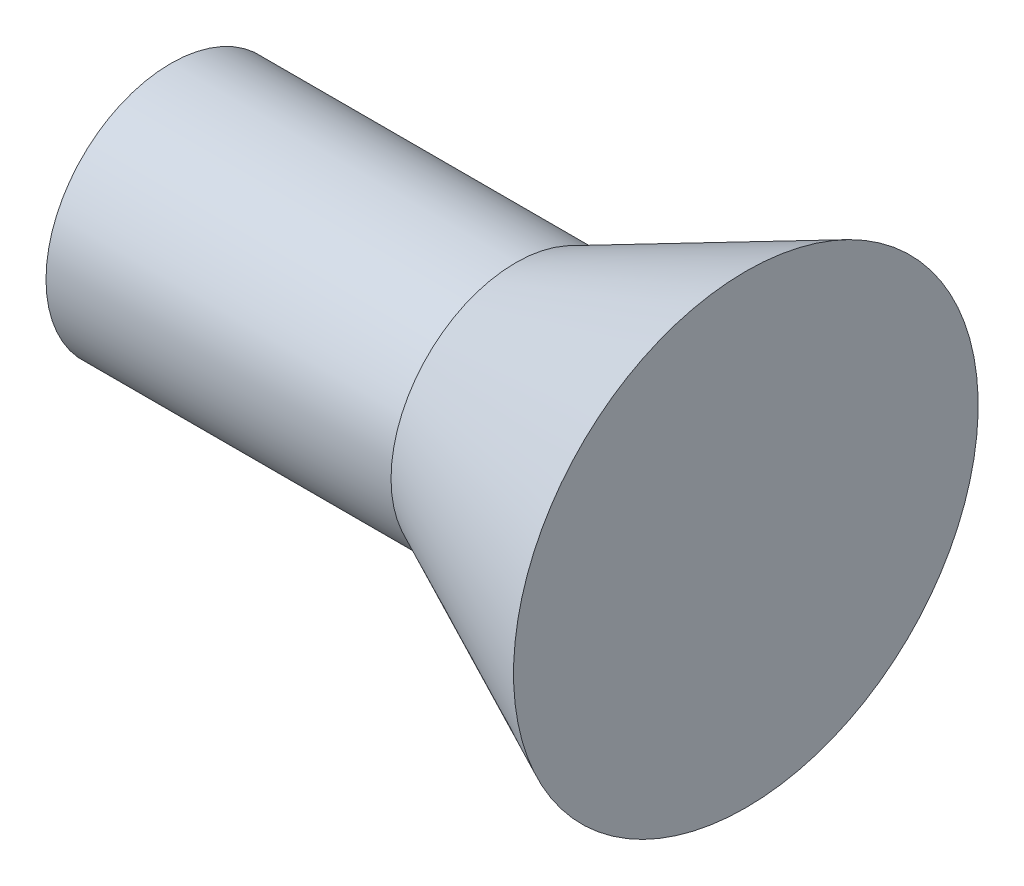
SolidWorks part; units mm, degrees
ref_plane "Front Plane" through (0, 0, 0) normal (0, 0, 1) x (1, 0, 0)
ref_plane "Top Plane" through (0, 0, 0) normal (0, 1, 0) x (1, 0, 0)
ref_plane "Right Plane" through (0, 0, 0) normal (1, 0, 0) x (0, 0, -1)
sketch "Sketch1" plane through (0, 0, 0) normal (0, 0, 1) x (1, 0, 0)
  line L0 (0, 0) -> (0, 5.425)
  line L1 (0, 5.425) -> (15, 5.425)
  line L2 (15, 5.425) -> (25, 10.1)
  line L3 (25, 10.1) -> (25, 0)
  line L4 (25, 0) -> (0, 0)
  dimension "D1" = 5.425
  dimension "D2" = 15
  dimension "D3" = 10.1
  dimension "D4" = 25
revolve "Revolve1" add sketch "Sketch1" angle 360 about L4
